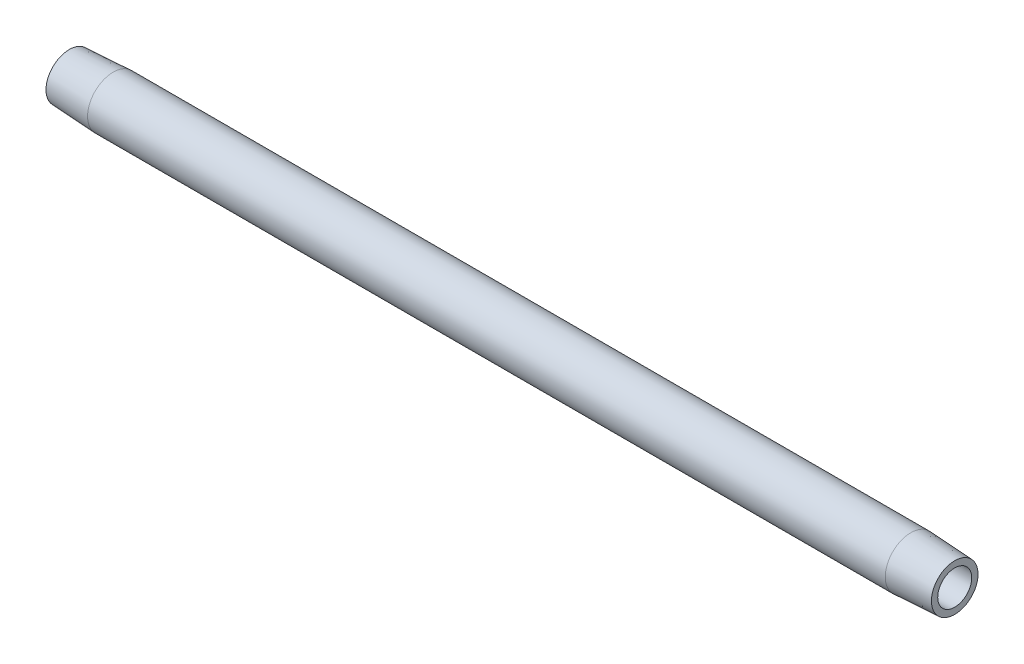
SolidWorks part; units mm, degrees
ref_plane "Front Plane" through (0, 0, 0) normal (0, 0, 1) x (1, 0, 0)
ref_plane "Top Plane" through (0, 0, 0) normal (0, 1, 0) x (1, 0, 0)
ref_plane "Right Plane" through (0, 0, 0) normal (1, 0, 0) x (0, 0, -1)
sketch "Sketch2" plane through (0, 0, 0) normal (0, 0, 1) x (1, 0, 0)
  line L0 (0.4761, 0) -> (50000.4761, 0) construction
  line L1 (0, -11.3625) -> (0, 49988.6375) construction
  line L7 (8.81, 5.1435) -> (0, 4.6818)
  line L8 (168.99, 5.1435) -> (8.81, 5.1435)
  line L9 (177.8, 4.6818) -> (168.99, 5.1435)
  line L10 (177.8, 3.4163) -> (177.8, 4.6818)
  line L11 (177.8, 3.4163) -> (0, 3.4163)
  line L12 (0, 4.6818) -> (0, 3.4163)
  dimension "D1" = 6.8326
  dimension "D2" = 10.287
  dimension "D3" = 3
  dimension "D4" = 3
  dimension "D5" = 8.81
  dimension "D6" = 8.81
  dimension "D7" = 177.8
revolve "Revolve1" add sketch "Sketch2" angle 360 about L0
